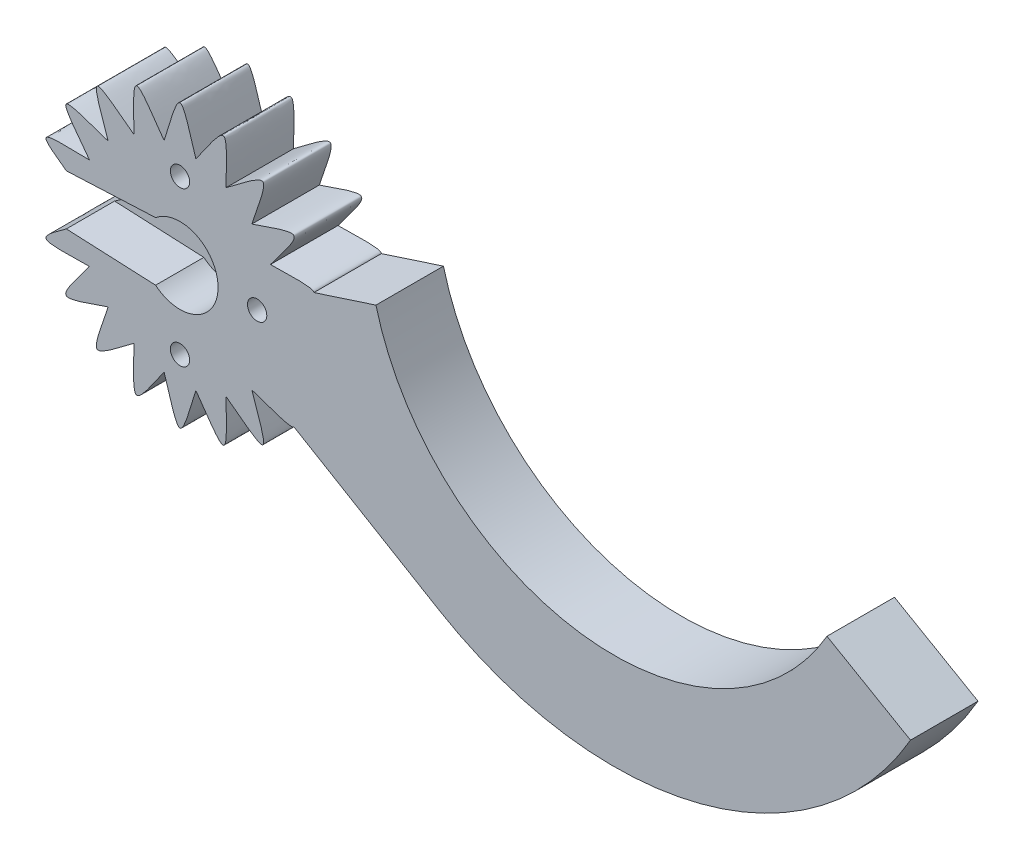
SolidWorks part; units mm, degrees
ref_plane "Plan de face" through (0, 0, 0) normal (0, 0, 1) x (1, 0, 0)
ref_plane "Plan de dessus" through (0, 0, 0) normal (0, 1, 0) x (1, 0, 0)
ref_plane "Plan de droite" through (0, 0, 0) normal (1, 0, 0) x (0, 0, -1)
sketch "Esquisse1" plane through (0, 0, 0) normal (0, 0, 1) x (1, 0, 0)
  line L0 (-33.1884, -21.5817) -> (-18.1223, -30.5259)
  line L1 (0, 0) -> (0, 25) construction
  line L2 (0, 0) -> (-25, 0) construction
  line L4 (-45, -13) -> (-59.6, -13) construction
  line L6 (22.0836, -12.75) -> (30.7439, -17.75)
  line L7 (-24.6841, -6.399) -> (-31.1146, -8.4884)
  line L8 (-28.1866, -21.5817) -> (-33.1884, -21.5817)
  circle A0 centre (0, 0) radius 25 construction
  arc A4 (30.7439, -17.75) -> (-28.1866, -21.5817) centre (0, 0) cw
  arc A5 (22.0836, -12.75) -> (-24.6841, -6.399) centre (0, 0) cw
  line B0 (-42.9664, -25.8399) -> (-45, -13) construction
  line B1 (-43.3528, -23.4) -> (-46.6472, -23.4) construction
  line B2 (-46.6472, -23.4) -> (-49.7804, -22.382) construction
  line B3 (-49.7804, -22.382) -> (-52.4456, -20.4456) construction
  line B4 (-52.4456, -20.4456) -> (-54.382, -17.7804) construction
  line B5 (-54.382, -17.7804) -> (-55.4, -14.6472) construction
  line B6 (-55.4, -14.6472) -> (-55.4, -11.3528) construction
  line B7 (-55.4, -11.3528) -> (-54.382, -8.2196) construction
  line B8 (-54.382, -8.2196) -> (-52.4456, -5.5544) construction
  line B9 (-52.4456, -5.5544) -> (-49.7804, -3.618) construction
  line B10 (-49.7804, -3.618) -> (-46.6472, -2.6) construction
  line B11 (-46.6472, -2.6) -> (-43.3528, -2.6) construction
  line B12 (-43.3528, -2.6) -> (-40.2196, -3.618) construction
  line B13 (-40.2196, -3.618) -> (-37.5544, -5.5544) construction
  line B14 (-37.5544, -5.5544) -> (-35.618, -8.2196) construction
  line B15 (-35.618, -8.2196) -> (-34.6, -11.3528) construction
  line B16 (-34.6, -11.3528) -> (-34.6, -14.6472) construction
  line B17 (-34.6, -14.6472) -> (-35.618, -17.7804) construction
  line B18 (-35.618, -17.7804) -> (-37.5544, -20.4456) construction
  line B19 (-37.5544, -20.4456) -> (-40.2196, -22.382) construction
  line B20 (-40.2196, -22.382) -> (-43.3528, -23.4) construction
  line B21 (-35.7335, -8.2785) -> (-34.728, -14.6269) construction
  line B22 (-45, -13) -> (-45, -29) construction
  circle B23 centre (-45, -13) radius 10.4 construction
  circle B24 centre (-45, -13) radius 1
  line B25 (-35.618, -8.2196) -> (-45, -13) construction
  line B26 (-34.6, -14.6472) -> (-45, -13) construction
  circle B27 centre (-45, -13) radius 8 construction
  circle B28 centre (-45, -21) radius 1
  circle B29 centre (-37, -13) radius 1
  circle B30 centre (-45, -5) radius 1
  circle B31 centre (-53, -13) radius 1
  dimension "D1" = 50
  dimension "D2" = 10
  dimension "D4" = 13
  dimension "D3" = 0.5
  dimension "D5" = 20
  dimension "D6" = 60
sketch_block_instance "Engrenage-2"
sketch_block "Engrenage" parameters "D1"=3, "D2"=1.2318, "D3"=1, "D4"=1.5
extrude "Boss.-Extru.2" add sketch "Esquisse1" along normal blind 7
sketch "Esquisse2" plane through (0, 0, 7) normal (0, 0, 1) x (1, 0, 0)
  line L0 (-47.5292, -9.9659) -> (-59.1653, -10.503)
  line L1 (-47.2091, -15.65) -> (-47.5292, -16.0341) construction
  line L2 (-59.1653, -15.497) -> (-47.5292, -16.0341)
  line L4 (-47.5292, -16.0341) -> (-47.5292, -9.9659) construction
  line L5 (-59.1591, -14.997) -> (-59.1653, -15.497) construction
  line L6 (-45, -13) -> (-59.05, -13) construction
  line L7 (-43.6163, -9.8396) -> (-43.4158, -9.3816) construction
  circle A2 centre (-45, -13) radius 3.95
  circle A3 centre (-59.05, -13) radius 2.4996
  line B0 (-59.1591, -11.003) -> (-47.2091, -10.35) construction
  line B1 (-47.2091, -15.65) -> (-59.1591, -14.997) construction
  arc B2 (-47.2091, -15.65) -> (-47.2091, -10.35) centre (-45, -13) ccw construction
  arc B3 (-59.1591, -11.003) -> (-59.1591, -14.997) centre (-59.05, -13) ccw construction
  dimension "D3" = 0.5
sketch_block_instance "Bloc1-1"
sketch_block "Bloc1"
extrude "Enlèv. mat.-Extru.2" cut sketch "Esquisse2" against normal blind 5
sketch "Esquisse7" plane through (0, 0, 7) normal (0, 0, 1) x (1, 0, 0)
  line L0 (-45, -13) -> (-32, -13) construction
  circle A0 centre (-45, -13) radius 13 construction
  dimension "D1" = 26
